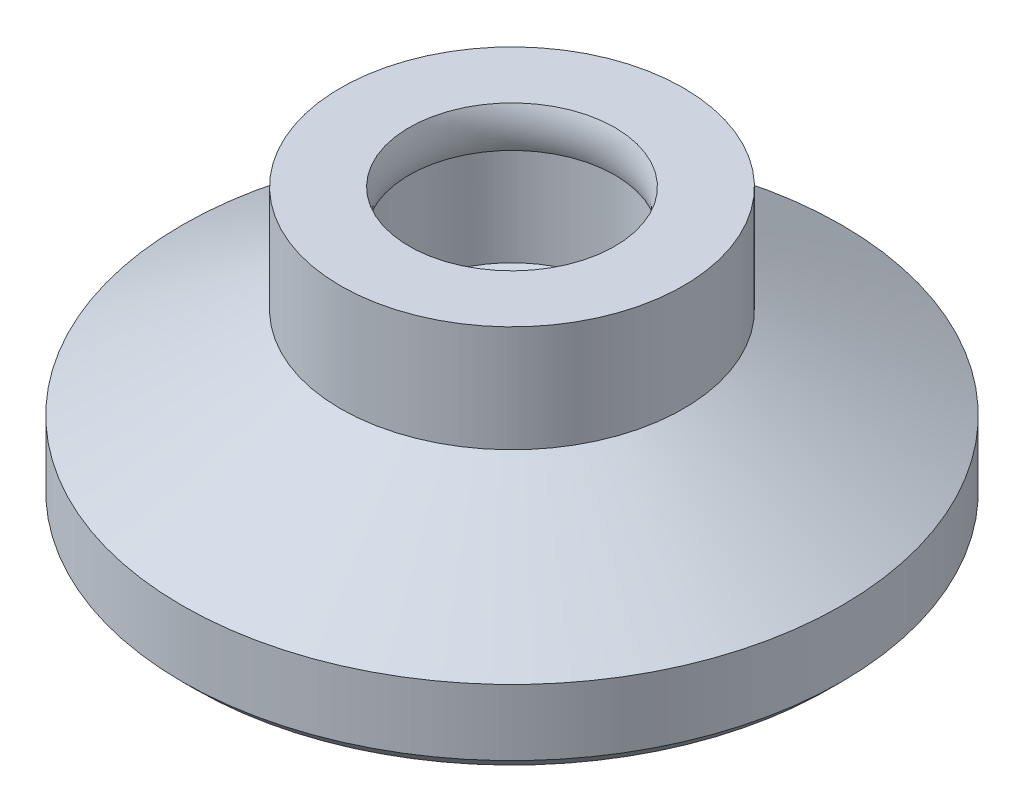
SolidWorks part; units mm, degrees
ref_plane "Front Plane" through (0, 0, 0) normal (0, 0, 1) x (1, 0, 0)
ref_plane "Top Plane" through (0, 0, 0) normal (0, 1, 0) x (1, 0, 0)
ref_plane "Right Plane" through (0, 0, 0) normal (1, 0, 0) x (0, 0, -1)
sketch "Sketch1" plane through (0, 0, 0) normal (0, 1, 0) x (1, 0, 0)
  circle A0 centre (0, 0) radius 6.5
  dimension "D1" = 13
extrude "Extrude1" add sketch "Sketch1" along normal mid plane 10.5
sketch "Sketch3" plane through (0, -5.25, 0) normal (0, -1, 0) x (1, 0, 0)
  circle A0 centre (0, 0) radius 12.5
  dimension "D1" = 25
extrude "Extrude2" add sketch "Sketch3" against normal blind 3
sketch "Sketch4" plane through (0, 0, 0) normal (0, 0, 1) x (1, 0, 0)
  line L0 (-12.5, -2.25) -> (-6.5, 1.2141)
  line L1 (-6.5, 5.25) -> (-6.5, -2.25) construction
  line L2 (-6.5, 1.2141) -> (-6.5, -2.25)
  line L3 (-6.5, -2.25) -> (-12.5, -2.25)
  dimension "D1" = 30
revolve "Revolve1" add sketch "Sketch4" angle 360 about axis through (0, 5.25, 0) along (0, -1, 0)
chamfer "Chamfer1" distance 0.5 angle 45 1 edges at (0, -5.25, -12.5)
sketch "Sketch5" plane through (0, 0, 0) normal (0, 0, 1) x (1, 0, 0)
  line L1 (0, 0) -> (0, 11.3083) construction
  line L2 (0, 5.25) -> (3.9, 5.25)
  line L3 (6.5, 5.25) -> (-6.5, 5.25) construction
  line L4 (3.9, 3.69) -> (3.9, 0.0017)
  line L5 (3.9, 0.0017) -> (0, -2.25)
  line L6 (0, -2.25) -> (0, 5.25)
  line L7 (12.5, -2.25) -> (-12.5, -2.25) construction
  arc A0 (3.9, 5.25) -> (3.9, 3.69) centre (5.772, 4.47) ccw
  point P14 (3.744, 4.47)
  dimension "D2" = 7.8
  dimension "D1" = 60
  dimension "D3" = 1.56
  dimension "D4" = 0.156
revolve "Cut-Revolve1" cut sketch "Sketch5" angle 360 about L1
equation "\"D3@Sketch5\" = \"D2@Sketch5\"*0.2"
equation "\"D4@Sketch5\" = \"D3@Sketch5\"*0.1"
